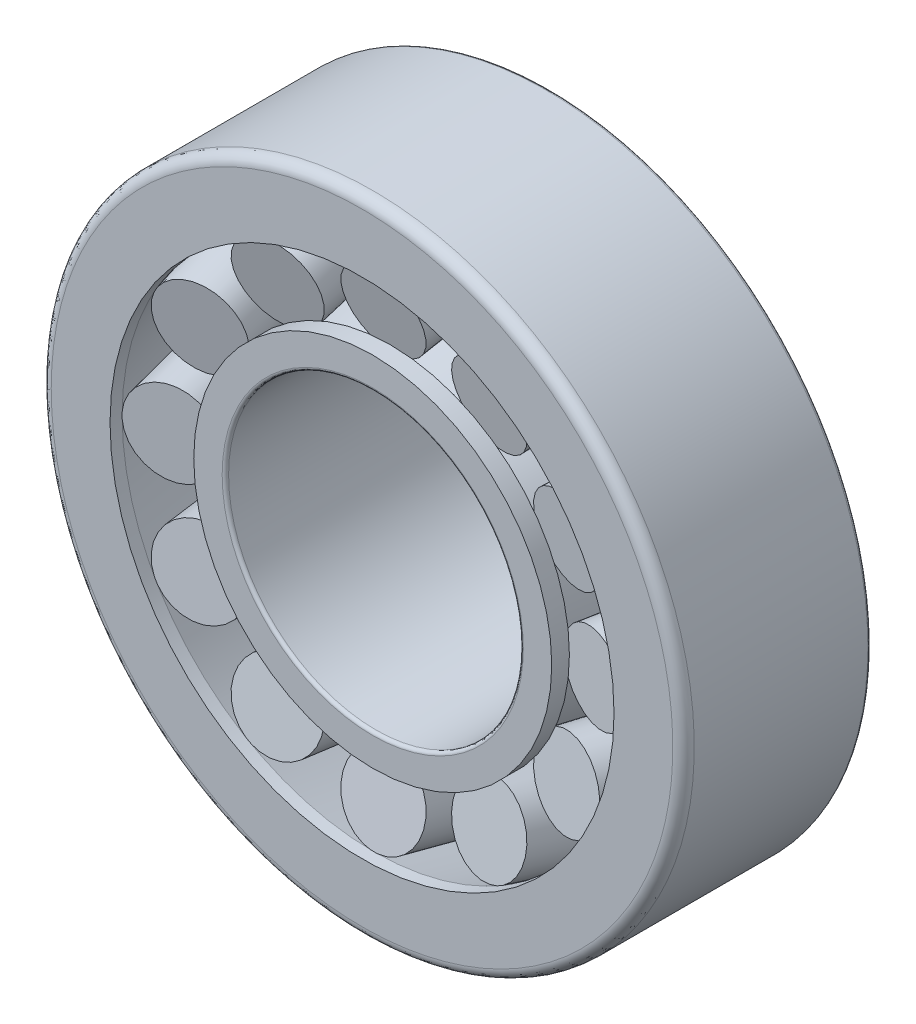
SolidWorks part; units mm, degrees
ref_plane "Front Plane" through (0, 0, 0) normal (0, 0, 1) x (1, 0, 0)
ref_plane "Top Plane" through (0, 0, 0) normal (0, 1, 0) x (1, 0, 0)
ref_plane "Right Plane" through (0, 0, 0) normal (1, 0, 0) x (0, 0, -1)
sketch "BaseSke" plane through (0, 0, 0) normal (1, 0, 0) x (0, 0, -1)
  line L0 (-47.2296, 0) -> (24.6132, 0) construction
  line L2 (0, 129.5214) -> (0, -86.3012) construction
  line L3 (-2.1506, 48.448) -> (-42.8494, 39.052) construction
  line L4 (-45, 60) -> (-10, 60) construction
  line L5 (-43, 27.5) -> (0, 27.5) construction
  line L6 (-22.5, 43.75) -> (-28.5892, 70.1254) construction
  line L7 (-42.75, 47.0507) -> (-12.25, 54.9386)
  line L8 (-12.25, 54.9386) -> (-10.3163, 46.5628)
  line L9 (-10.3163, 46.5628) -> (-41.0018, 39.4785)
  line L10 (-41.0018, 39.4785) -> (-42.75, 47.0507)
  line L11 (-45, 60) -> (-45, 47.0312) construction
  line L12 (-42.7455, 47.0312) -> (-10, 55.4998) construction
  line L13 (-10, 60) -> (-10, 55.4998) construction
  line L14 (-42.7455, 47.0312) -> (-45, 47.0312) construction
  line L15 (-39.2536, 31.9063) -> (-8.3826, 38.1871) construction
  line L16 (-43, 27.5) -> (-43, 33.4063) construction
  line L17 (-43, 33.4063) -> (-39.7026, 33.4063) construction
  line L18 (0, 39.6871) -> (0, 27.5) construction
  line L19 (-39.7026, 33.4063) -> (-39.3629, 31.9351) construction
  line L20 (-39.3629, 31.9351) -> (-8.2958, 38.2558) construction
  line L21 (-8.2958, 38.2558) -> (-8.6263, 39.6871) construction
  line L22 (-8.6263, 39.6871) -> (0, 39.6871) construction
  dimension "D2" = 22.5
  dimension "D1" = 0.02
  dimension "Outer_Thickness" = 35
  dimension "Bearing_Outside_Diameter" = 120
  dimension "Bearing_Inside_Diameter" = 55
  dimension "Inner_Thickness" = 43
  dimension "Bearing_Thickness" = 45
  dimension "Angle" = 13
  dimension "D3" = 87.5
  dimension "D4" = 2.25
  dimension "D5" = 2.25
  dimension "D6" = 1.5
  dimension "D7" = 0.1
  dimension "Roller_diameter" = 94.0625
  dimension "D8" = 1.5
  dimension "D9" = 0.05
  dimension "D10" = 0.1
  dimension "D11" = 1.5
revolve "Roller" add sketch "BaseSke" angle 360 about L3
sketch "OuterRaceSke" plane through (0, 0, 0) normal (1, 0, 0) x (0, 0, -1)
  line L0 (-42.7455, 47.0312) -> (-45, 47.0312) construction
  line L1 (-42.7455, 47.0312) -> (-10, 55.4998) construction
  line L2 (-10, 60) -> (-10, 55.4998) construction
  line L3 (-45, 60) -> (-10, 60) construction
  line L4 (-45, 60) -> (-45, 47.0312) construction
  line L5 (-42.7455, 47.0312) -> (-45, 47.0312)
  line L6 (-42.7455, 47.0312) -> (-10, 55.4998)
  line L7 (-10, 60) -> (-10, 55.4998)
  line L8 (-45, 60) -> (-10, 60)
  line L9 (-45, 60) -> (-45, 47.0312)
  line L10 (-60.3939, 0) -> (35.9926, 0) construction
revolve "OuterRace" add sketch "OuterRaceSke" angle 360 about L10
sketch "InnerRaceSke" plane through (0, 0, 0) normal (1, 0, 0) x (0, 0, -1)
  line L0 (-43, 27.5) -> (0, 27.5) construction
  line L1 (-43, 27.5) -> (-43, 33.4063) construction
  line L2 (-43, 33.4063) -> (-39.7026, 33.4063) construction
  line L3 (-39.7026, 33.4063) -> (-39.3629, 31.9351) construction
  line L4 (-39.3629, 31.9351) -> (-8.2958, 38.2558) construction
  line L5 (-8.2958, 38.2558) -> (-8.6263, 39.6871) construction
  line L6 (-8.6263, 39.6871) -> (0, 39.6871) construction
  line L7 (0, 39.6871) -> (0, 27.5) construction
  line L8 (-43, 27.5) -> (0, 27.5)
  line L9 (-43, 27.5) -> (-43, 33.4063)
  line L10 (-43, 33.4063) -> (-39.7026, 33.4063)
  line L11 (-39.7026, 33.4063) -> (-39.3629, 31.9351)
  line L12 (-39.3629, 31.9351) -> (-8.2958, 38.2558)
  line L13 (-8.2958, 38.2558) -> (-8.6263, 39.6871)
  line L14 (-8.6263, 39.6871) -> (0, 39.6871)
  line L15 (0, 39.6871) -> (0, 27.5)
  line L16 (-58.1022, 0) -> (39.538, 0) construction
revolve "InnerRace" add sketch "InnerRaceSke" angle 360 about L16
fillet "Fillet1" radius 0.6 2 edges at (60, 0, 10) (27.5, 0, 43)
fillet "InnerFillet" radius 2.5 1 edges at (27.5, 0, 0)
fillet "OuterFillet" radius 2 1 edges at (60, 0, 45)
pattern_circular "CirPatternBall" count 12 over 360 about axis through (0, 0, 0) along (0, 0, 1) of "Roller"
sketch "Sketch4" plane through (0, 0, 0) normal (1, 0, 0) x (0, 0, -1)
  line L0 (-42.75, 47.0507) -> (-12.25, 54.9386)
  line L1 (-12.25, 54.9386) -> (-8.3826, 38.1871)
  line L2 (-8.3826, 38.1871) -> (-39.2536, 31.9063)
  line L3 (-39.2536, 31.9063) -> (-42.75, 47.0507)
  line L4 (-40.3293, 0) -> (19.5574, 0) construction
revolve "Simplified" [suppressed] add sketch "Sketch4" angle 360 about L4
equation "\"D2@BaseSke\" = \"Bearing_Thickness@BaseSke\"/2"
equation "\"D3@BaseSke\" =  ( \"Bearing_Outside_Diameter@BaseSke\" + \"Bearing_Inside_Diameter@BaseSke\" )  / 2"
equation "\"Roller_diameter@BaseSke\" = \"D3@BaseSke\"*1.075"
equation "\"D4@BaseSke\" = \"Bearing_Thickness@BaseSke\"/20"
equation "\"D5@BaseSke\" = \"Bearing_Thickness@BaseSke\" / 20"
equation "\"D8@BaseSke\" = \"Bearing_Thickness@BaseSke\"/30"
equation "\"D11@BaseSke\" = \"D8@BaseSke\""
equation "\"D1@CirPatternBall\" = int(  \"D3@BaseSke\" *  pi  /  ( \"Bearing_Outside_Diameter@BaseSke\" - \"Bearing_Inside_Diameter@BaseSke\" )  * 3 ) "
